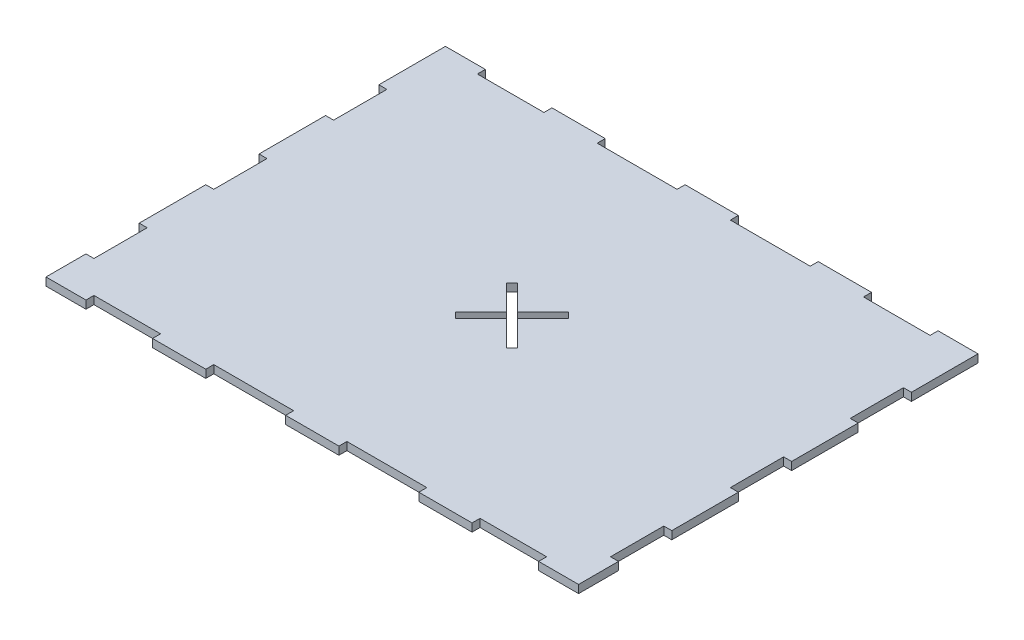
SolidWorks part; units mm, degrees
ref_plane "Alzado" through (0, 0, 0) normal (0, 0, 1) x (1, 0, 0)
ref_plane "Planta" through (0, 0, 0) normal (0, 1, 0) x (1, 0, 0)
ref_plane "Vista lateral" through (0, 0, 0) normal (1, 0, 0) x (0, 0, -1)
sketch "Croquis3" plane through (0, 0, 0) normal (0, 1, 0) x (1, 0, 0)
  line L1 (0, 0) -> (200, 0)
  line L2 (0, 0) -> (0, 150)
  line L3 (0, 150) -> (200, 150)
  line L4 (200, 0) -> (200, 150)
extrude "Saliente-Extruir1" add sketch "Croquis3" along normal blind 3
sketch "Croquis4" plane through (0, 3, 0) normal (0, 1, 0) x (1, 0, 0)
  line L0 (0, 125) -> (0, 105)
  line L1 (200, 150) -> (0, 150) construction
  line L2 (185, 3) -> (185, 0)
  line L3 (15, 150) -> (40, 150)
  line L4 (15, 150) -> (15, 147)
  line L5 (15, 147) -> (40, 147)
  line L6 (40, 150) -> (40, 147)
  line L7 (160, 0) -> (185, 0)
  line L8 (60, 147) -> (90, 147)
  line L9 (60, 147) -> (60, 150)
  line L10 (60, 150) -> (90, 150)
  line L11 (90, 147) -> (90, 150)
  line L12 (160, 3) -> (160, 0)
  line L13 (110, 150) -> (140, 150)
  line L14 (110, 150) -> (110, 147)
  line L15 (110, 147) -> (140, 147)
  line L16 (140, 150) -> (140, 147)
  line L17 (0, 125) -> (3, 125)
  line L18 (160, 147) -> (185, 147)
  line L19 (160, 147) -> (160, 150)
  line L20 (160, 150) -> (185, 150)
  line L21 (185, 147) -> (185, 150)
  line L22 (160, 3) -> (185, 3)
  line L23 (140, 0) -> (140, 3)
  line L24 (110, 3) -> (140, 3)
  line L25 (110, 0) -> (110, 3)
  line L26 (110, 0) -> (140, 0)
  line L27 (90, 3) -> (90, 0)
  line L28 (60, 0) -> (90, 0)
  line L29 (60, 3) -> (60, 0)
  line L30 (60, 3) -> (90, 3)
  line L31 (40, 0) -> (40, 3)
  line L32 (15, 3) -> (40, 3)
  line L33 (15, 0) -> (15, 3)
  line L34 (15, 0) -> (40, 0)
  line L35 (0, 150) -> (0, 0) construction
  line L36 (3, 125) -> (3, 105)
  line L37 (3, 105) -> (0, 105)
  line L38 (0, 80) -> (0, 60)
  line L39 (0, 80) -> (3, 80)
  line L40 (3, 80) -> (3, 60)
  line L41 (3, 60) -> (0, 60)
  line L43 (0, 35) -> (3, 35)
  line L44 (3, 35) -> (3, 15)
  line L45 (3, 15) -> (0, 15)
  line L46 (0, 15) -> (0, 35)
  line L47 (200, 15) -> (200, 35)
  line L48 (197, 15) -> (200, 15)
  line L49 (197, 35) -> (197, 15)
  line L50 (200, 35) -> (197, 35)
  line L51 (197, 60) -> (200, 60)
  line L52 (197, 80) -> (197, 60)
  line L53 (200, 80) -> (197, 80)
  line L54 (200, 80) -> (200, 60)
  line L55 (197, 105) -> (200, 105)
  line L56 (197, 125) -> (197, 105)
  line L57 (200, 125) -> (197, 125)
  line L58 (200, 125) -> (200, 105)
  line L60 (100, 77.1213) -> (109.5459, 86.6673)
  line L61 (88.3327, 65.4541) -> (97.8787, 75)
  line L73 (88.3327, 65.4541) -> (90.4541, 63.3327)
  line L74 (90.4541, 63.3327) -> (100, 72.8787)
  line L76 (88.3327, 84.5459) -> (90.4541, 86.6673)
  line L77 (109.5459, 86.6673) -> (111.6673, 84.5459)
  line L79 (88.3327, 84.5459) -> (97.8787, 75)
  line L81 (90.4541, 86.6673) -> (100, 77.1213)
  line L82 (109.5459, 63.3327) -> (111.6673, 65.4541)
  line L86 (100, 72.8787) -> (109.5459, 63.3327)
  line L88 (102.1213, 75) -> (111.6673, 84.5459)
  line L89 (102.1213, 75) -> (111.6673, 65.4541)
  point P39 (100, 75)
  point P68 (100, 75)
extrude "Cortar-Extruir1" cut sketch "Croquis4" against normal blind 6
